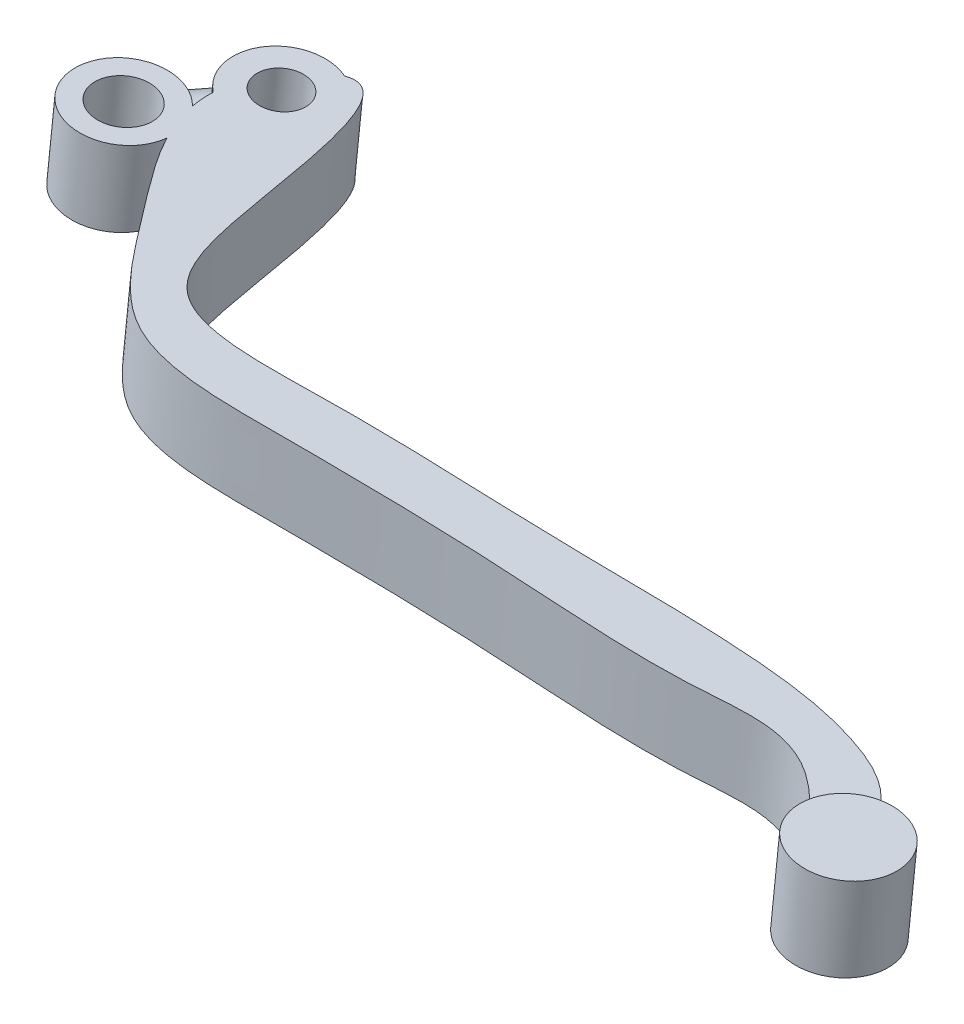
SolidWorks part; units mm, degrees
ref_plane "Alzado" through (0, 0, 0) normal (0, 0, 1) x (1, 0, 0)
ref_plane "Planta" through (0, 0, 0) normal (0, 1, 0) x (1, 0, 0)
ref_plane "Vista lateral" through (0, 0, 0) normal (1, 0, 0) x (0, 0, -1)
sketch3d "Sk_puntos_Plano_palanca"
  point P0 (247.8038, 40.2316, -26.1614)
  point P1 (297.3062, 35.1814, -31.0616)
  point P2 (252.6788, 39.7343, 23.5979)
ref_plane "Plano_palanca" through (6.6148, 64.8378, 0) normal (-0.1015, -0.9948, 0) x (-0.9948, 0.1015, 0)
sketch "Sk_Palanca" plane through (6.6148, 64.8378, 0) normal (-0.1015, -0.9948, 0) x (-0.9948, 0.1015, 0)
  spline S0 degree 3 poles (-254.9118, 3.3768) (-241.8709, -13.9666) (-252.1672, -26.5391) (-262.1509, -40.9172) (-282.5977, -38.6131) (-302.0678, -36.9124) (-321.774, -36.7308) (-335.8922, -32.7728) (-346.4274, -47.4224) (-345.1262, -34.2001) (-335.6003, -29.8606) (-321.0748, -29.329) (-301.3541, -31.6126) (-282.7257, -32.1429) (-261.0715, -35.6467) (-257.2358, -19.9312) (-254.9118, 3.3768) (-241.8709, -13.9666) (-252.1672, -26.5391) knots -0.158059 -0.111967 -0.033021 0 0.078946 0.135623 0.200779 0.301384 0.381877 0.43514 0.476712 0.500852 0.542424 0.595686 0.67618 0.776785 0.841941 0.888033 0.966979 1 1.078946 1.135623 1.200779 only from (-246.2677, -9.6359) to (-246.2677, -9.6359)
extrude "Palanca" add sketch "Sk_Palanca" along normal mid plane 9
sketch3d "Sk_Buje_pivote"
  line L0 (253.8287, 35.0936, 8.3663) -> (254.7422, 44.0471, 8.3663)
  dimension "D1" = 9
sweep "Buje_pivote" add path "Sk_Buje_pivote" parameters "D3"=11
sketch3d "Sk_Bola"
  line L0 (349.3548, 24.8454, 40.1035) -> (350.3697, 34.7938, 40.1035)
  dimension "D1" = 10
sweep "Bola" add path "Sk_Bola" parameters "D3"=11
sketch3d "Sk_Brazo_cabezal"
  line L0 (254.2854, 39.5704, 8.3663) -> (247.241, 40.289, 19.112)
  dimension "D1" = 12.869
sweep "Brazo_cabezal" add path "Sk_Brazo_cabezal" parameters "D3"=8
sketch3d "Sk_Oreja_cabezal"
  line L0 (246.7843, 35.8123, 19.112) -> (247.6978, 44.7658, 19.112)
  dimension "D1" = 9
sweep "Oreja_cabezal" add path "Sk_Oreja_cabezal" parameters "D3"=11
sketch3d "Sk_Agujero_pivote"
  line L0 (253.4735, 31.6117, 8.3663) -> (255.0974, 47.5291, 8.3663)
  dimension "D1" = 16
sweep "Agujero_pivote" cut path "Sk_Agujero_pivote" parameters "D3"=5.5
sketch3d "Sk_Alojamiento_cabezal"
  line L0 (246.6321, 34.32, 19.112) -> (247.85, 46.2581, 19.112)
  dimension "D1" = 12
sweep "Alojamiento_cabezal" cut path "Sk_Alojamiento_cabezal" parameters "D3"=6.5
sketch3d "Sk_Salida_cable"
  line L0 (247.241, 40.289, 19.112) -> (238.5451, 41.1762, 22.1835)
  dimension "D1" = 9.265
sweep "Salida_cable" cut path "Sk_Salida_cable" parameters "D3"=2
